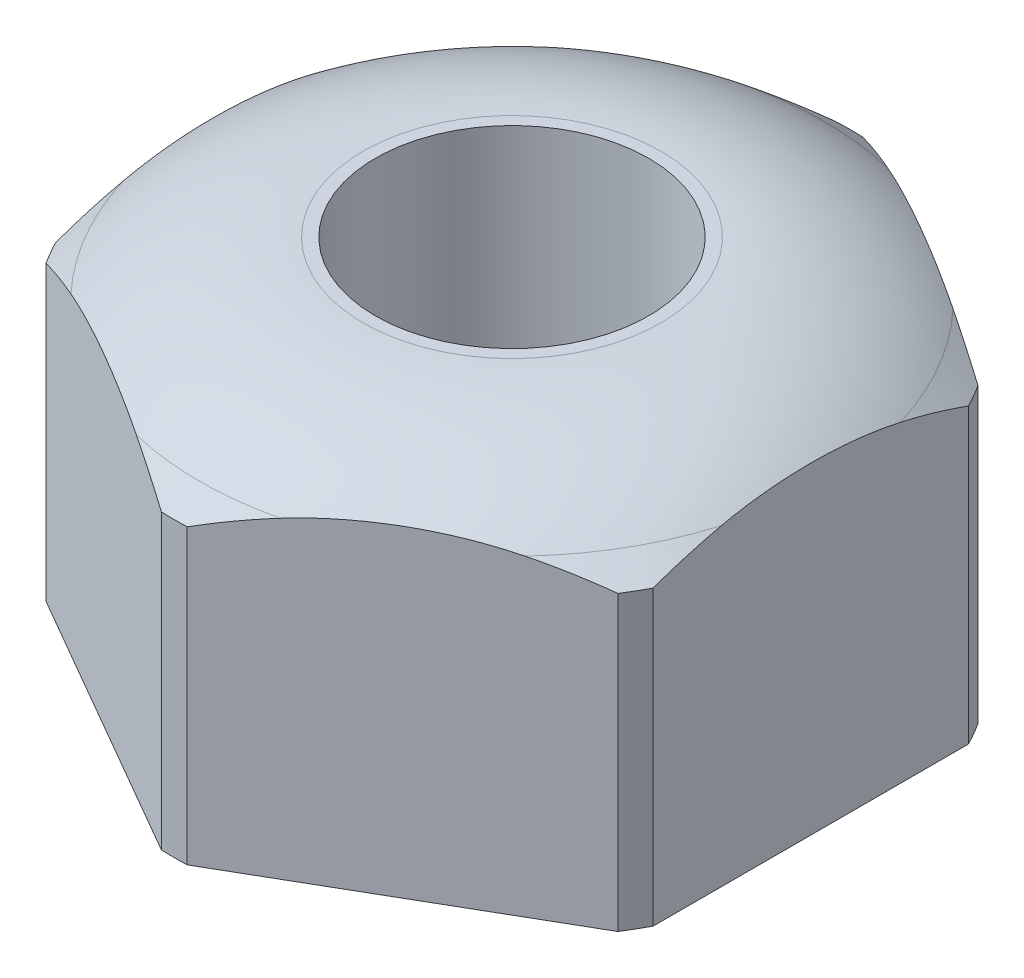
SolidWorks part; units mm, degrees
ref_plane "Front" through (0, 0, 0) normal (0, 0, 1) x (1, 0, 0)
ref_plane "Top" through (0, 0, 0) normal (0, 1, 0) x (1, 0, 0)
ref_plane "Right" through (0, 0, 0) normal (1, 0, 0) x (0, 0, -1)
sketch "Sketch1" plane through (0, 0, 0) normal (0, 0, 1) x (1, 0, 0)
  line L0 (0, -25.4) -> (0, 25.4) construction
  line L1 (1.4224, 0) -> (1.4224, 3.8354)
  line L2 (3.5179, 3.048) -> (3.248, 3.255)
  line L3 (1.4224, 3.8354) -> (1.5494, 3.8354)
  line L4 (-3.5179, 3.048) -> (-3.5179, 0) construction
  line L7 (3.5179, 0) -> (1.4224, 0)
  line L10 (3.5179, 3.048) -> (3.5179, 0)
  arc A0 (1.5494, 3.8354) -> (3.248, 3.255) centre (1.5494, 1.0596) cw
  dimension "D1" = 3.8354
  dimension "D2" = 7.0358
  dimension "D3" = 3.048
  dimension "D4" = 1.4224
  dimension "D5" = 127.486
  dimension "D6" = 0.127
revolve "Base-Revolve" add sketch "Sketch1" angle 360 about L0
sketch "Sketch2" plane through (0, 0, 0) normal (0, 1, 0) x (1, 0, 0)
  line L0 (3.1115, 1.7964) -> (0, 3.5929)
  line L1 (0, 3.5929) -> (-3.1115, 1.7964)
  line L2 (-3.1115, 1.7964) -> (-3.1115, -1.7964)
  line L3 (-3.1115, -1.7964) -> (0, -3.5929)
  line L4 (0, -3.5929) -> (3.1115, -1.7964)
  line L5 (3.1115, -1.7964) -> (3.1115, 1.7964)
  line L6 (20.7527, 19.5533) -> (-19.7306, 19.5533)
  line L7 (-19.7306, 19.5533) -> (-19.7306, -19.5374)
  line L8 (-19.7306, -19.5374) -> (20.7527, -19.5374)
  line L9 (20.7527, -19.5374) -> (20.7527, 19.5533)
  line L10 (0, 0) -> (3.1115, 1.7964) construction
  line L11 (0, 0) -> (3.1115, -1.7964) construction
  line L12 (0, 0) -> (0, 3.5929) construction
  dimension "D1" = 6.223
  dimension "D2" = 60
  dimension "D3" = 60
extrude "Cut-Extrude1" cut sketch "Sketch2" along normal blind 31.6992
